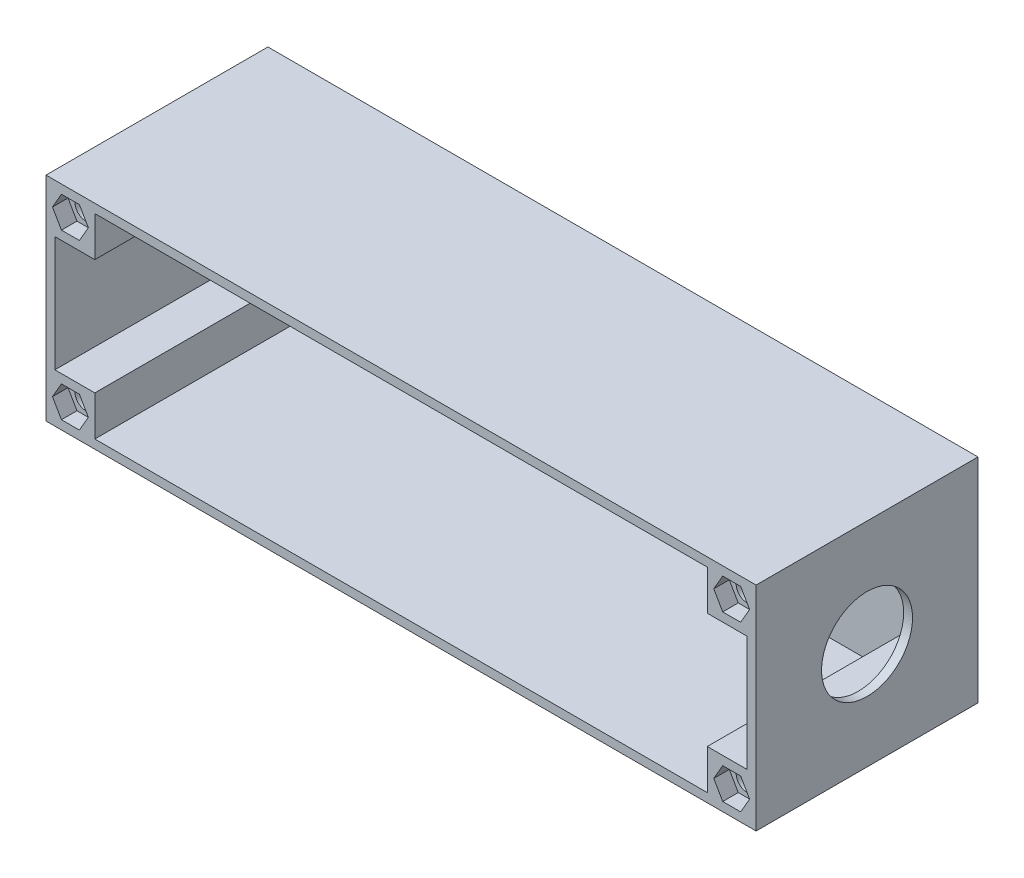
SolidWorks part; units mm, degrees
ref_plane "Ebene vorne" through (0, 0, 0) normal (0, 0, 1) x (1, 0, 0)
ref_plane "Ebene oben" through (0, 0, 0) normal (0, 1, 0) x (1, 0, 0)
ref_plane "Ebene rechts" through (0, 0, 0) normal (1, 0, 0) x (0, 0, -1)
sketch "Skizze1" plane through (0, 0, 0) normal (0, 0, 1) x (1, 0, 0)
  line L1 (0, 0) -> (160, 0)
  line L2 (0, 0) -> (0, 48)
  line L3 (0, 48) -> (160, 48)
  line L4 (160, 0) -> (160, 48)
  dimension "D1" = 160
  dimension "D2" = 48
extrude "Aufsatz-Linear austragen2" add sketch "Skizze1" along normal blind 50
sketch "Skizze2" plane through (0, 0, 50) normal (0, 0, 1) x (1, 0, 0)
  line L0 (0, 48) -> (0, 0) construction
  line L1 (11, 46) -> (149, 46)
  line L2 (2, 37) -> (2, 11)
  line L3 (11, 2) -> (149, 2)
  line L4 (158, 37) -> (158, 11)
  line L5 (160, 48) -> (0, 48) construction
  line L6 (0, 0) -> (160, 0) construction
  line L7 (160, 0) -> (160, 48) construction
  line L12 (2, 11) -> (11, 11)
  line L13 (11, 11) -> (11, 2)
  line L14 (11, 46) -> (11, 37)
  line L15 (11, 37) -> (2, 37)
  line L16 (149, 2) -> (149, 11)
  line L17 (149, 11) -> (158, 11)
  line L18 (149, 46) -> (149, 37)
  line L19 (149, 37) -> (158, 37)
  point P0 (2, 46)
  point P1 (158, 2)
  point P2 (2, 2)
  point P3 (158, 46)
  dimension "D1" = 2
  dimension "D2" = 2
  dimension "D3" = 2
  dimension "D4" = 2
  dimension "D5" = 11
  dimension "D6" = 11
  dimension "D7" = 11
  dimension "D8" = 11
  dimension "D9" = 11
  dimension "D10" = 11
  dimension "D11" = 11
  dimension "D12" = 11
other "AusrichtungGruppe1"
extrude "Schnitt-Linear austragen1" cut sketch "Skizze2" against normal blind 44
sketch "Skizze3" plane through (160, 0, 0) normal (1, 0, 0) x (0, 0, -1)
  line L0 (-50, 24) -> (0, 24) construction
  line L1 (-50, 0) -> (-50, 48) construction
  line L2 (0, 0) -> (0, 48) construction
  line L3 (-25, 24) -> (-25, 48) construction
  line L4 (-50, 48) -> (0, 48) construction
  line L5 (-25, 48) -> (-25, 0) construction
  line L6 (-50, 0) -> (0, 0) construction
  circle A0 centre (-25, 24) radius 10.25
  dimension "D1" = 20.5
extrude "Schnitt-Linear austragen2" cut sketch "Skizze3" against normal blind 3 contours A0
sketch "Skizze4" plane through (0, 0, 0) normal (0, 0, -1) x (-1, 0, 0)
  line L0 (-160, 24) -> (0, 24) construction
  line L1 (-160, 0) -> (-160, 48) construction
  line L2 (0, 48) -> (0, 0) construction
  line L3 (-160, 48) -> (0, 48) construction
  line L4 (-80, 48) -> (-80, 0) construction
  line L5 (0, 0) -> (-160, 0) construction
  circle A0 centre (-120, 24) radius 13
  circle A1 centre (-40, 24) radius 13
  dimension "D1" = 40
  dimension "D3" = 26
  dimension "D4" = 26
  dimension "D2" = 40
extrude "Schnitt-Linear austragen3" cut sketch "Skizze4" against normal blind 4
sketch "Skizze6" plane through (0, 0, 50) normal (0, 0, 1) x (1, 0, 0)
  line L0 (5.5, 48) -> (5.5, 37) construction
  line L1 (160, 48) -> (0, 48) construction
  line L2 (11, 37) -> (2, 37) construction
  line L3 (0, 42.5) -> (11, 42.5) construction
  line L4 (0, 48) -> (0, 0) construction
  line L5 (11, 46) -> (11, 37) construction
  line L6 (80, 48) -> (80, 0) construction
  line L7 (9.5415, 42.5) -> (7.5207, 46)
  line L8 (7.5207, 46) -> (3.4793, 46)
  line L9 (3.4793, 46) -> (1.4585, 42.5)
  line L10 (1.4585, 42.5) -> (3.4793, 39)
  line L11 (3.4793, 39) -> (7.5207, 39)
  line L12 (7.5207, 39) -> (9.5415, 42.5)
  line L13 (0, 0) -> (160, 0) construction
  line L14 (0, 24) -> (160, 24) construction
  line L15 (160, 0) -> (160, 48) construction
  line L16 (152.4793, 39) -> (150.4585, 42.5)
  line L17 (156.5207, 39) -> (152.4793, 39)
  line L18 (158.5415, 42.5) -> (156.5207, 39)
  line L19 (156.5207, 46) -> (158.5415, 42.5)
  line L20 (152.4793, 46) -> (156.5207, 46)
  line L21 (150.4585, 42.5) -> (152.4793, 46)
  line L22 (7.5207, 9) -> (9.5415, 5.5)
  line L23 (3.4793, 9) -> (7.5207, 9)
  line L24 (1.4585, 5.5) -> (3.4793, 9)
  line L25 (3.4793, 2) -> (1.4585, 5.5)
  line L26 (7.5207, 2) -> (3.4793, 2)
  line L27 (9.5415, 5.5) -> (7.5207, 2)
  line L28 (156.5207, 9) -> (152.4793, 9)
  line L29 (158.5415, 5.5) -> (156.5207, 9)
  line L30 (156.5207, 2) -> (158.5415, 5.5)
  line L31 (152.4793, 2) -> (156.5207, 2)
  line L32 (150.4585, 5.5) -> (152.4793, 2)
  line L33 (152.4793, 9) -> (150.4585, 5.5)
  circle A0 centre (5.5, 42.5) radius 3.5 construction
  circle A1 centre (154.5, 42.5) radius 3.5 construction
  circle A2 centre (5.5, 5.5) radius 3.5 construction
  circle A3 centre (154.5, 5.5) radius 3.5 construction
  dimension "D1" = 5.5
  dimension "D2" = 5.5
extrude "Schnitt-Linear austragen4" cut sketch "Skizze6" against normal blind 3.5
sketch "Skizze8" plane through (0, 0, 50) normal (0, 0, 1) x (1, 0, 0)
  line L0 (5.5, 46) -> (5.5, 39) construction
  line L1 (7.5207, 46) -> (3.4793, 46) construction
  line L2 (3.4793, 39) -> (7.5207, 39) construction
  line L3 (1.4585, 42.5) -> (9.5415, 42.5) construction
  line L4 (80, 48) -> (80, 0) construction
  line L5 (160, 48) -> (0, 48) construction
  line L6 (0, 0) -> (160, 0) construction
  line L7 (0, 24) -> (160, 24) construction
  line L8 (0, 48) -> (0, 0) construction
  line L9 (160, 0) -> (160, 48) construction
  circle A0 centre (5.5, 42.5) radius 2.5
  circle A1 centre (154.5, 42.5) radius 2.5
  circle A2 centre (154.5, 5.5) radius 2.5
  circle A3 centre (5.5, 5.5) radius 2.5
  dimension "D1" = 5
extrude "Schnitt-Linear austragen5" cut sketch "Skizze8" against normal blind 10
sketch "Skizze9" plane through (0, 0, 0) normal (0, 0, -1) x (-1, 0, 0)
  line L0 (-80, 48) -> (-80, 0) construction
  line L1 (-160, 48) -> (0, 48) construction
  line L2 (0, 0) -> (-160, 0) construction
  line L3 (-160, 24) -> (0, 24) construction
  line L4 (-160, 0) -> (-160, 48) construction
  line L5 (0, 48) -> (0, 0) construction
  line L6 (-144.5, 24) -> (-141.5, 24) construction
  line L7 (-144.5, 26.5) -> (-141.5, 26.5)
  line L8 (-144.5, 21.5) -> (-141.5, 21.5)
  line L9 (-15.5, 24) -> (-18.5, 24) construction
  line L10 (-15.5, 26.5) -> (-18.5, 26.5)
  line L11 (-15.5, 21.5) -> (-18.5, 21.5)
  arc A0 (-144.5, 26.5) -> (-144.5, 21.5) centre (-144.5, 24) ccw
  arc A1 (-141.5, 21.5) -> (-141.5, 26.5) centre (-141.5, 24) ccw
  arc A2 (-15.5, 26.5) -> (-15.5, 21.5) centre (-15.5, 24) cw
  arc A3 (-18.5, 21.5) -> (-18.5, 26.5) centre (-18.5, 24) cw
  point P14 (-143, 24)
  point P19 (-147, 24)
  point P20 (-139, 24)
  point P21 (-80, 24)
  point P24 (-17, 24)
  dimension "D1" = 5
  dimension "D2" = 8
  dimension "D3" = 63
extrude "Schnitt-Linear austragen6" cut sketch "Skizze9" against normal blind 13.5
